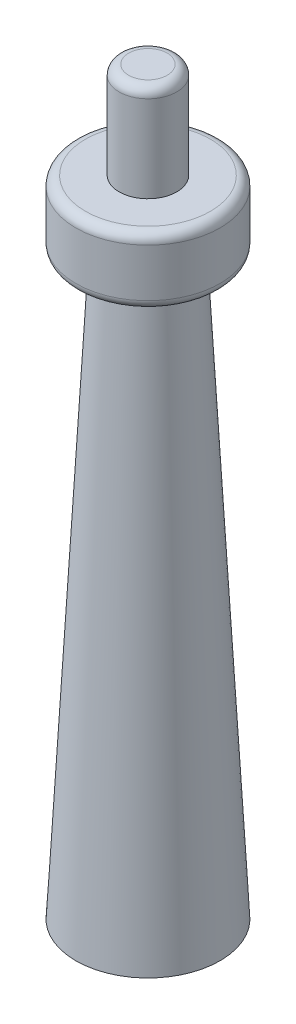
SolidWorks part; units mm, degrees
ref_plane "Plan de face" through (0, 0, 0) normal (0, 0, 1) x (1, 0, 0)
ref_plane "Plan de dessus" through (0, 0, 0) normal (0, 1, 0) x (1, 0, 0)
ref_plane "Plan de droite" through (0, 0, 0) normal (1, 0, 0) x (0, 0, -1)
sketch "Esquisse1" plane through (0, 0, 0) normal (0, 1, 0) x (1, 0, 0)
  circle A0 centre (0, 0) radius 750
  dimension "D1" = 1500
extrude "Boss.-Extru.1" add sketch "Esquisse1" along normal blind 6000 draft 3
sketch "Esquisse2" plane through (0, 6000, 0) normal (0, 1, 0) x (1, 0, 0)
  circle A0 centre (0, 0) radius 750
  dimension "D1" = 1500
extrude "Boss.-Extru.2" add sketch "Esquisse2" along normal blind 700
fillet "Congé1" radius 100 1 edges at (0, 6000, 435.5533)
fillet "Congé2" radius 100 1 edges at (0, 6000, 750)
fillet "Congé3" radius 100 1 edges at (0, 6700, 750)
sketch "Esquisse3" plane through (0, 6700, 0) normal (0, 1, 0) x (1, 0, 0)
  circle A0 centre (0, 0) radius 300
  dimension "D1" = 600
extrude "Boss.-Extru.3" add sketch "Esquisse3" along normal blind 1000
fillet "Congé4" radius 100 1 edges at (0, 7700, 300)
